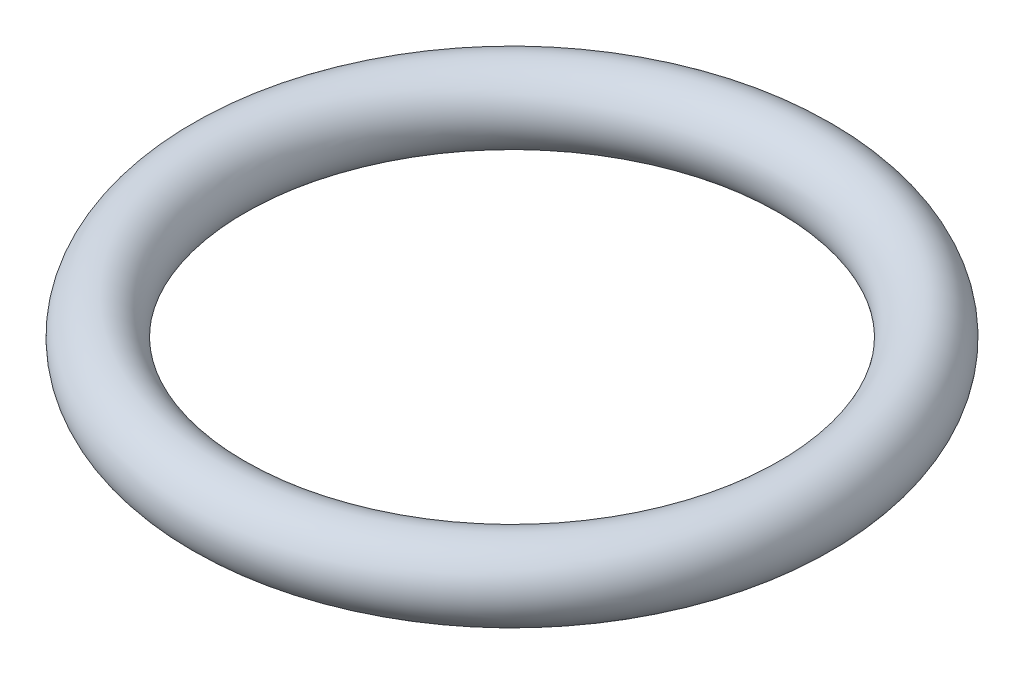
SolidWorks part; units mm, degrees
ref_plane "Front Plane" through (0, 0, 0) normal (0, 0, 1) x (1, 0, 0)
ref_plane "Top Plane" through (0, 0, 0) normal (0, 1, 0) x (1, 0, 0)
ref_plane "Right Plane" through (0, 0, 0) normal (1, 0, 0) x (0, 0, -1)
ref_axis "Axis1" through (0, 55, 0) along (0, -1, 0)
sketch "Sketch1" plane through (0, 0, 0) normal (0, 0, 1) x (1, 0, 0)
  circle A0 centre (-8, 0) radius 1
  dimension "D1" = 2
  dimension "D2" = 7
revolve "Revolve1" add sketch "Sketch1" angle 360 about axis through (0, 55, 0) along (0, -1, 0)
